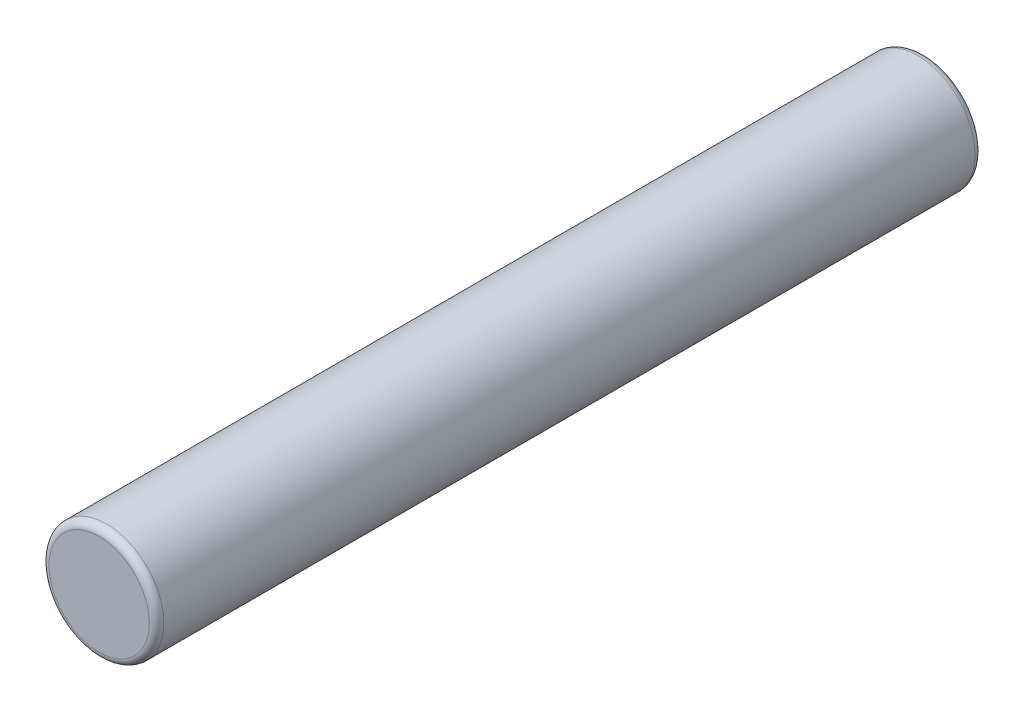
SolidWorks part; units mm, degrees
ref_plane "Front Plane" through (0, 0, 0) normal (0, 0, 1) x (1, 0, 0)
ref_plane "Top Plane" through (0, 0, 0) normal (0, 1, 0) x (1, 0, 0)
ref_plane "Right Plane" through (0, 0, 0) normal (1, 0, 0) x (0, 0, -1)
sketch "Sketch1" plane through (0, 0, 0) normal (0, 0, 1) x (1, 0, 0)
  circle A0 centre (0, 0) radius 7.925
  dimension "D1" = 15.85
extrude "Extrude1" add sketch "Sketch1" along normal blind 114
fillet "Fillet1" radius 1 2 edges at (7.925, 0, 0) (7.925, 0, 114)
